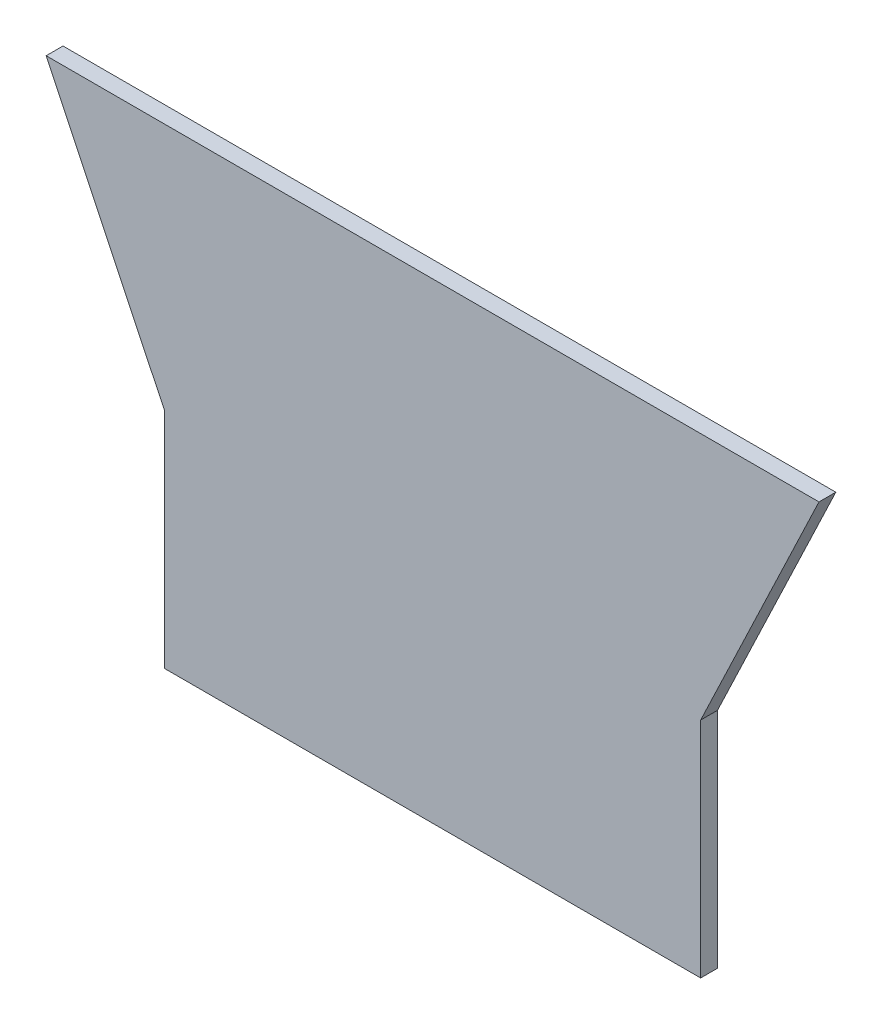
SolidWorks part; units mm, degrees
ref_plane "Front Plane" through (0, 0, 0) normal (0, 0, 1) x (1, 0, 0)
ref_plane "Top Plane" through (0, 0, 0) normal (0, 1, 0) x (1, 0, 0)
ref_plane "Right Plane" through (0, 0, 0) normal (1, 0, 0) x (0, 0, -1)
ref_plane "Front Plane-Bucket_Floor" through (0, 0, 0) normal (0, 0, 1) x (1, 0, 0)
ref_plane "Top Plane-Bucket_Floor" through (0, 0, 0) normal (0, 1, 0) x (1, 0, 0)
ref_plane "Right Plane-Bucket_Floor" through (0, 0, 0) normal (1, 0, 0) x (0, 0, -1)
sketch "Sketch1-Bucket_Floor" plane through (0, 0, 0) normal (0, 0, 1) x (1, 0, 0)
  line L0 (-50.546, 21.0608) -> (-72.8591, 67.8392)
  line L1 (50.546, -21.0608) -> (-50.546, -21.0608)
  line L2 (50.546, -21.0608) -> (50.546, 21.0608)
  line L4 (-50.546, -21.0608) -> (-50.546, 21.0608)
  line L5 (50.546, -21.0608) -> (-50.546, 21.0608) construction
  line L6 (50.546, 21.0608) -> (-50.546, -21.0608) construction
  line L7 (-72.8591, 67.8392) -> (72.8591, 67.8392)
  line L8 (72.8591, 67.8392) -> (50.546, 21.0608)
  point P0 (0, 0)
  dimension "D1" = 101.092
  dimension "D2" = 88.9
  dimension "D3" = 205.501
  dimension "D4" = 42.1217
inserted part "Bucket_Floor"
sketch "Sketch2" plane through (0, 0, 0) normal (0, 0, 1) x (1, 0, 0)
  line L0 (-72.8591, 67.8392) -> (-50.546, 21.0608)
  line L1 (-50.546, 21.0608) -> (-50.546, -21.0608)
  line L2 (-50.546, -21.0608) -> (50.546, -21.0608)
  line L3 (50.546, -21.0608) -> (50.546, 21.0608)
  line L4 (50.546, 21.0608) -> (72.8591, 67.8392)
  line L5 (72.8591, 67.8392) -> (-72.8591, 67.8392)
extrude "Boss-Extrude1" add sketch "Sketch2" along normal blind 3.175
